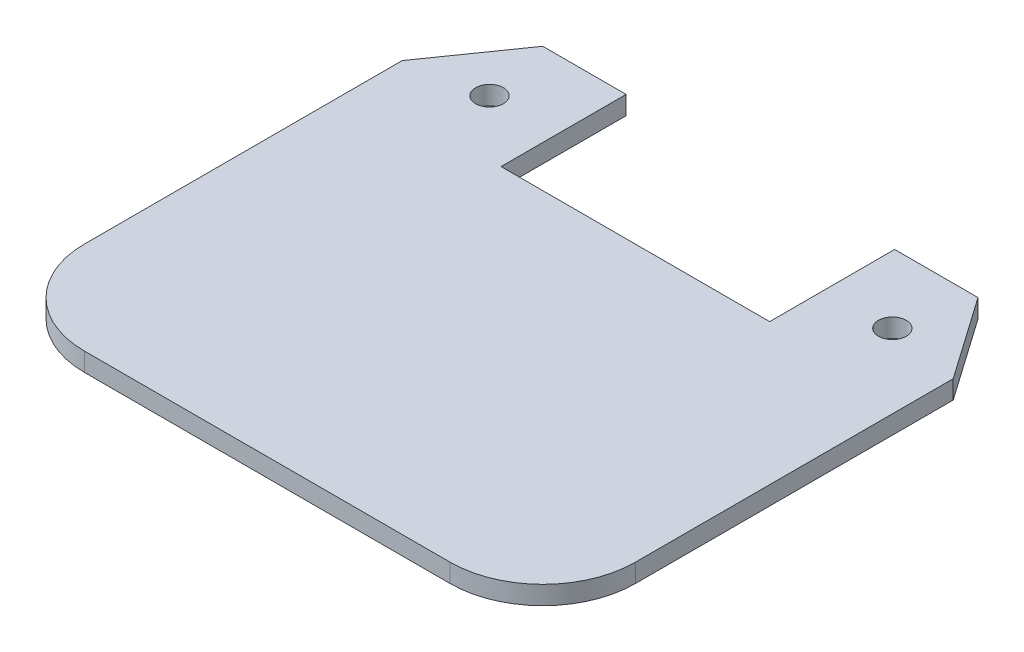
SolidWorks part; units mm, degrees
ref_plane "前视基准面" through (0, 0, 0) normal (0, 0, 1) x (1, 0, 0)
ref_plane "上视基准面" through (0, 0, 0) normal (0, 1, 0) x (1, 0, 0)
ref_plane "右视基准面" through (0, 0, 0) normal (1, 0, 0) x (0, 0, -1)
other "Configuration Table"
sketch "草图1" plane through (0, 0, 0) normal (0, 1, 0) x (1, 0, 0)
  line L0 (5.95, 3.5398) -> (4.7, 5.325)
  line L1 (-5.95, -5.325) -> (5.95, -5.325)
  line L2 (-5.95, -5.325) -> (-5.95, 5.325) construction
  line L3 (-5.95, 5.325) -> (5.95, 5.325) construction
  line L4 (5.95, -5.325) -> (5.95, 5.325) construction
  line L5 (-5.95, -5.325) -> (5.95, 5.325) construction
  line L6 (-5.95, 5.325) -> (5.95, -5.325) construction
  line L7 (4.7, 5.325) -> (-4.7, 5.325)
  line L8 (-4.7, 5.325) -> (-5.95, 3.5398)
  line L9 (-5.95, 3.5398) -> (-5.95, -5.325)
  line L10 (5.95, 3.5398) -> (5.95, -5.325)
  point P0 (0, 0)
  point P8 (0, 5.325)
  dimension "D1" = 11.9
  dimension "D2" = 10.65
  dimension "D3" = 9.4
  dimension "D4" = 125
  dimension "D5" = 125
extrude "凸台-拉伸1" add sketch "草图1" along normal blind 0.4
sketch "草图2" plane through (0, 0.4, 0) normal (0, 1, 0) x (1, 0, 0)
  line L1 (5.95, -5.325) -> (5.95, 3.5398) construction
  line L7 (-5.95, 3.5398) -> (-5.95, -5.325) construction
  line L13 (4.7, 5.325) -> (-4.7, 5.325) construction
  line L17 (2.9, 5.325) -> (-2.9, 5.325)
  line L18 (2.9, 5.325) -> (2.9, 2.625)
  line L19 (2.9, 2.625) -> (-2.9, 2.625)
  line L20 (-2.9, 5.325) -> (-2.9, 2.625)
  circle A0 centre (-4.35, 3.825) radius 0.3
  circle A1 centre (4.35, 3.825) radius 0.3
  point P6 (0, 0)
  point P7 (0, 2.625)
  dimension "D3" = 0.6
  dimension "D4" = 0.6
  dimension "D1" = 5.8
  dimension "D2" = 2.7
  dimension "D5" = 1.5
  dimension "D6" = 1.6
  dimension "D7" = 1.6
extrude "切除-拉伸1" cut sketch "草图2" against normal blind 10
fillet "圆角1" radius 2 2 edges at (-5.95, 0.2, 5.325) (5.95, 0.2, 5.325)
